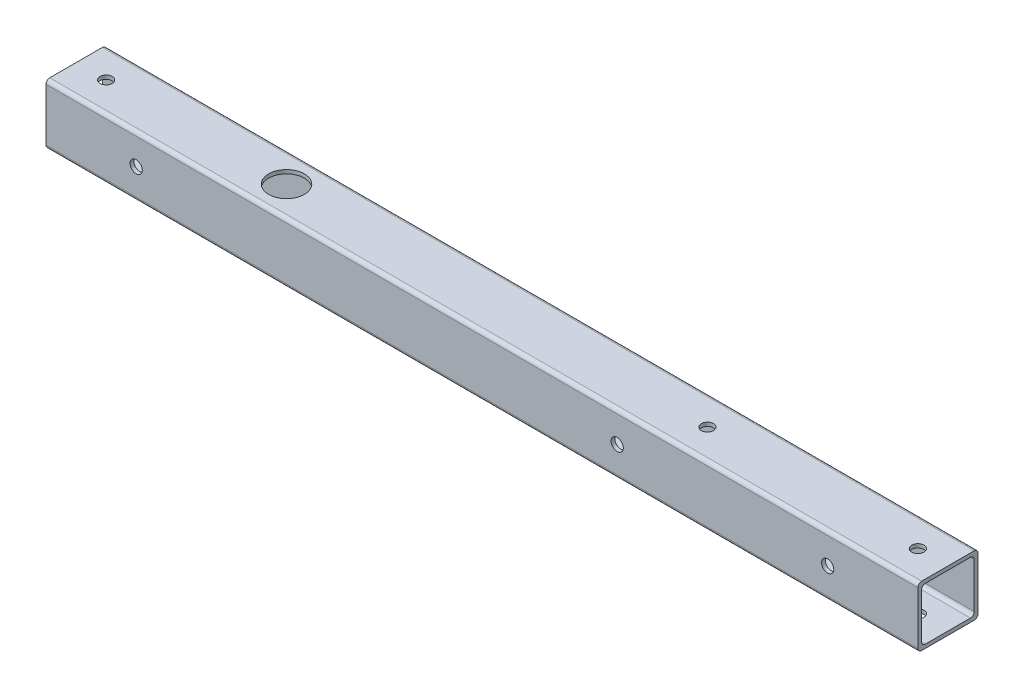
SolidWorks part; units mm, degrees
ref_plane "Front Plane" through (0, 0, 0) normal (0, 0, 1) x (1, 0, 0)
ref_plane "Top Plane" through (0, 0, 0) normal (0, 1, 0) x (1, 0, 0)
ref_plane "Right Plane" through (0, 0, 0) normal (1, 0, 0) x (0, 0, -1)
sketch "Sketch1" plane through (0, 0, 0) normal (0, 1, 0) x (1, 0, 0)
  line L1 (0, 0) -> (-1473.2, 0)
  line L2 (0, 0) -> (0, -101.6)
  line L3 (0, -101.6) -> (-1473.2, -101.6)
  line L4 (-1473.2, 0) -> (-1473.2, -101.6)
  dimension "D1" = 1473.2
  dimension "D2" = 101.6
extrude "Extrude1" add sketch "Sketch1" along normal blind 101.6
sketch "Sketch2" plane through (-1473.2, 0, 0) normal (-1, 0, 0) x (0, 0, 1)
  line L0 (0, 101.6) -> (101.6, 101.6) construction
  line L1 (6.35, 95.25) -> (95.25, 95.25)
  line L2 (6.35, 95.25) -> (6.35, 6.35)
  line L3 (6.35, 6.35) -> (95.25, 6.35)
  line L4 (95.25, 95.25) -> (95.25, 6.35)
  line L5 (0, 0) -> (101.6, 0) construction
  line L6 (101.6, 101.6) -> (101.6, 0) construction
  line L7 (0, 101.6) -> (0, 0) construction
  dimension "D1" = 6.35
  dimension "D2" = 6.35
  dimension "D3" = 6.35
  dimension "D4" = 6.35
extrude "Cut-Extrude1" cut sketch "Sketch2" against normal up to next
fillet "Fillet1" radius 6.35 8 edges at (-736.6, 6.35, 95.25) (-736.6, 0, 101.6) (-736.6, 101.6, 101.6) (-736.6, 95.25, 95.25) (-736.6, 95.25, 6.35) (-736.6, 101.6, 0) (-736.6, 6.35, 6.35) (-736.6, 0, 0)
sketch "Sketch3" plane through (0, 101.6, 0) normal (0, 1, 0) x (1, 0, 0)
  line L0 (0, -95.25) -> (0, -6.35) construction
  line L1 (0, -6.35) -> (-1473.2, -6.35) construction
  circle A0 centre (-1422.4, -50.8) radius 10.3188
  dimension "D1" = 20.6375
  dimension "D2" = 1422.4
  dimension "D3" = 44.45
extrude "Cut-Extrude2" cut sketch "Sketch3" against normal blind 101.6
sketch "Sketch4" plane through (0, 101.6, 0) normal (0, 1, 0) x (1, 0, 0)
  line L0 (0, -95.25) -> (0, -6.35) construction
  line L1 (0, -6.35) -> (-1473.2, -6.35) construction
  circle A0 centre (-50.8, -50.8) radius 10.3188
  dimension "D1" = 20.6375
  dimension "D2" = 50.8
  dimension "D3" = 44.45
extrude "Cut-Extrude3" cut sketch "Sketch4" against normal blind 101.6
sketch "Sketch5" plane through (0, 101.6, 0) normal (0, 1, 0) x (1, 0, 0)
  line L0 (0, -95.25) -> (0, -6.35) construction
  line L1 (0, -6.35) -> (-1473.2, -6.35) construction
  circle A0 centre (-1117.6, -50.8) radius 30.1625
  dimension "D1" = 60.325
  dimension "D2" = 1117.6
  dimension "D3" = 44.45
extrude "Cut-Extrude4" cut sketch "Sketch5" against normal blind 101.6
sketch "Sketch6" plane through (0, 0, 0) normal (0, 0, -1) x (-1, 0, 0)
  line L0 (0, 95.25) -> (0, 6.35) construction
  line L1 (1473.2, 95.25) -> (0, 95.25) construction
  circle A0 centre (1320.8, 50.8) radius 10.3188
  dimension "D1" = 20.6375
  dimension "D2" = 1320.8
  dimension "D3" = 44.45
extrude "Cut-Extrude5" cut sketch "Sketch6" against normal blind 101.6
sketch "Sketch7" plane through (0, 0, 0) normal (0, 0, -1) x (-1, 0, 0)
  line L0 (1473.2, 95.25) -> (1473.2, 6.35) construction
  line L1 (1473.2, 95.25) -> (0, 95.25) construction
  circle A0 centre (152.4, 50.8) radius 10.3187
  dimension "D1" = 20.6375
  dimension "D2" = 1320.8
  dimension "D3" = 44.45
extrude "Cut-Extrude6" cut sketch "Sketch7" against normal blind 101.6
sketch "Sketch8" plane through (0, 0, 0) normal (0, 0, -1) x (-1, 0, 0)
  line L0 (0, 95.25) -> (0, 6.35) construction
  line L1 (1473.2, 95.25) -> (0, 95.25) construction
  circle A0 centre (508, 50.8) radius 10.3187
  dimension "D1" = 20.6375
  dimension "D2" = 508
  dimension "D3" = 44.45
extrude "Cut-Extrude7" cut sketch "Sketch8" against normal blind 101.6
sketch "Sketch9" plane through (0, 101.6, 0) normal (0, 1, 0) x (1, 0, 0)
  line L0 (-1473.2, -6.35) -> (-1473.2, -95.25) construction
  line L1 (0, -6.35) -> (-1473.2, -6.35) construction
  circle A0 centre (-406.4, -50.8) radius 10.3187
  dimension "D1" = 20.6375
  dimension "D2" = 1066.8
  dimension "D3" = 44.45
extrude "Cut-Extrude8" cut sketch "Sketch9" against normal blind 101.6
